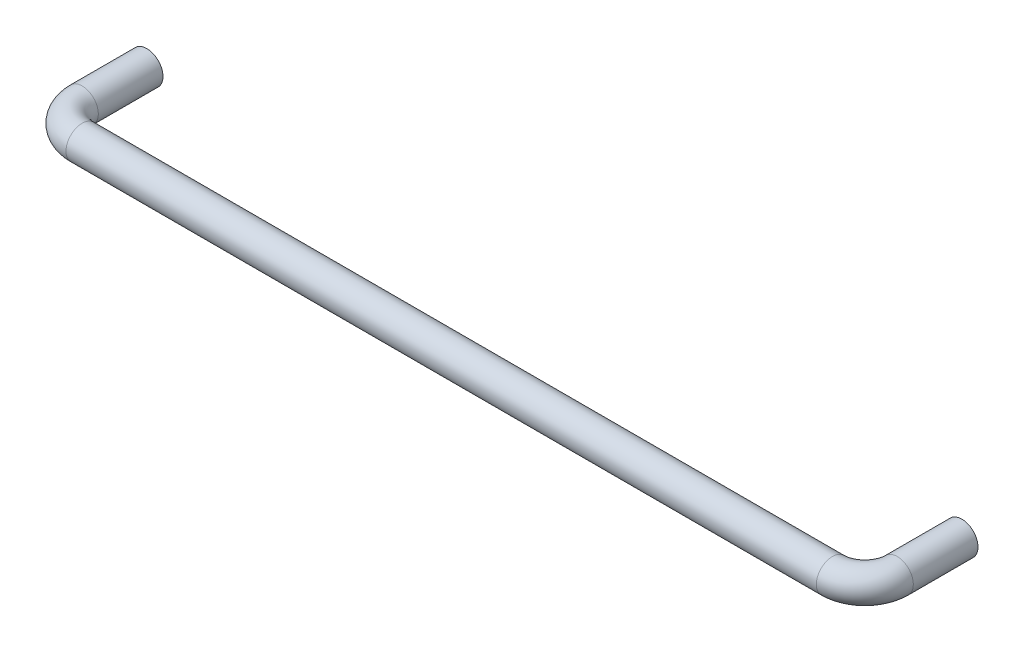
SolidWorks part; units mm, degrees
mirror "Mirror All1"
sweep "Base-Sweep" add profiles "Sketch1" path "3DSketch1"
sketch "Sketch1" plane through (0, 0, 0) normal (0, 0, 1) x (1, 0, 0)
  circle A0 centre (0, 0) radius 5
  dimension "D1" = 10
sketch3d "3DSketch1"
  line L0 (0, 0, 0) -> (0, 0, 20)
  line L1 (10, 0, 30) -> (126, 0, 30)
  line L2 (126, 0, 30) -> (126, 0, 0) construction
  line L3 (0, 0, 0) -> (126, 0, 0) construction
  arc A0 (0, 0, 20) -> (10, 0, 30) centre (10, 0, 20) ccw
  point P7 (0, 0, 30)
  point P8 (10, 10, 20)
  dimension "D1" = 10
  dimension "D2" = 30
  dimension "D3" = 126
hole_wizard "M3.0 (3.000000) Diameter Hole1" positions "Sketch3" profile "Sketch2" hole size "M3.0" standard "Ansi Metric"
sketch "Sketch3" plane through (0, 0, 0) normal (0, 0, -1) x (-1, 0, 0)
  point P0 (0, 0)
sketch "Sketch2" plane through (0, 0, 0) normal (1, 0, 0) x (0, 1, 0)
  line L0 (0, 0) -> (0, 3.9013)
  line L1 (0, 3.9013) -> (1.5, 3)
  line L2 (1.5, 3) -> (1.5, 0)
  line L5 (1.5, 0) -> (0, 0)
  line L10 (0, 3.9013) -> (-1.5, 3) construction
  line L11 (0, -6.35) -> (0, 107.95) construction
  dimension "Hole Dia." = 3
  dimension "Hole Depth" = 3
  dimension "Drill Angle" = 118
ref_plane "Front" through (0, 0, 0) normal (0, 0, 1) x (1, 0, 0)
ref_plane "Top" through (0, 0, 0) normal (0, 1, 0) x (1, 0, 0)
ref_plane "Right" through (0, 0, 0) normal (1, 0, 0) x (0, 0, -1)
